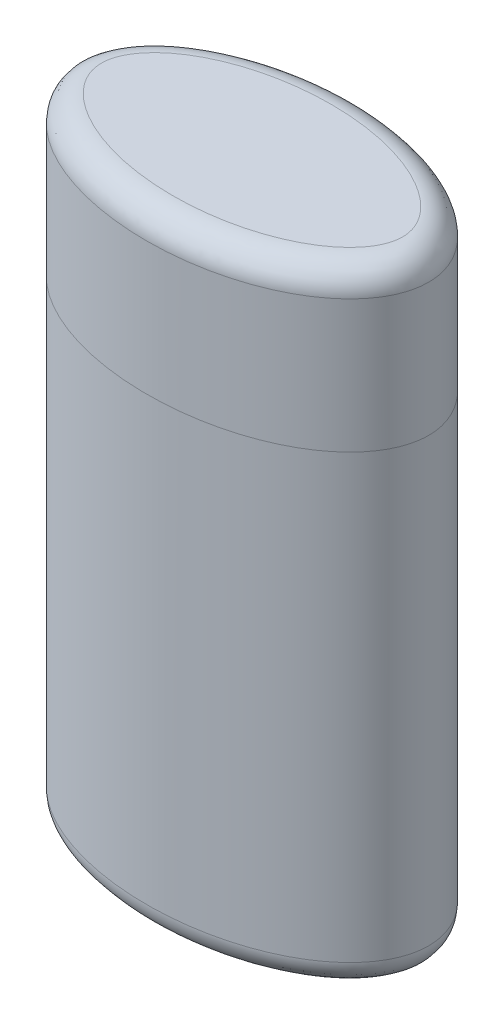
SolidWorks part; units mm, degrees
ref_plane "Front" through (0, 0, 0) normal (0, 0, 1) x (1, 0, 0)
ref_plane "Top" through (0, 0, 0) normal (0, 1, 0) x (1, 0, 0)
ref_plane "Right" through (0, 0, 0) normal (1, 0, 0) x (0, 0, -1)
sketch "Sketch2"
extrude "Extrude1" add sketch "Sketch2" along normal blind 304.8
fillet "Fillet1" radius 12.7 2 edges at (85.8994, 0, 0) (85.8994, 304.8, 0)
shell "Shell1" thickness 7.62
sketch "Sketch3"
split "Split1"
